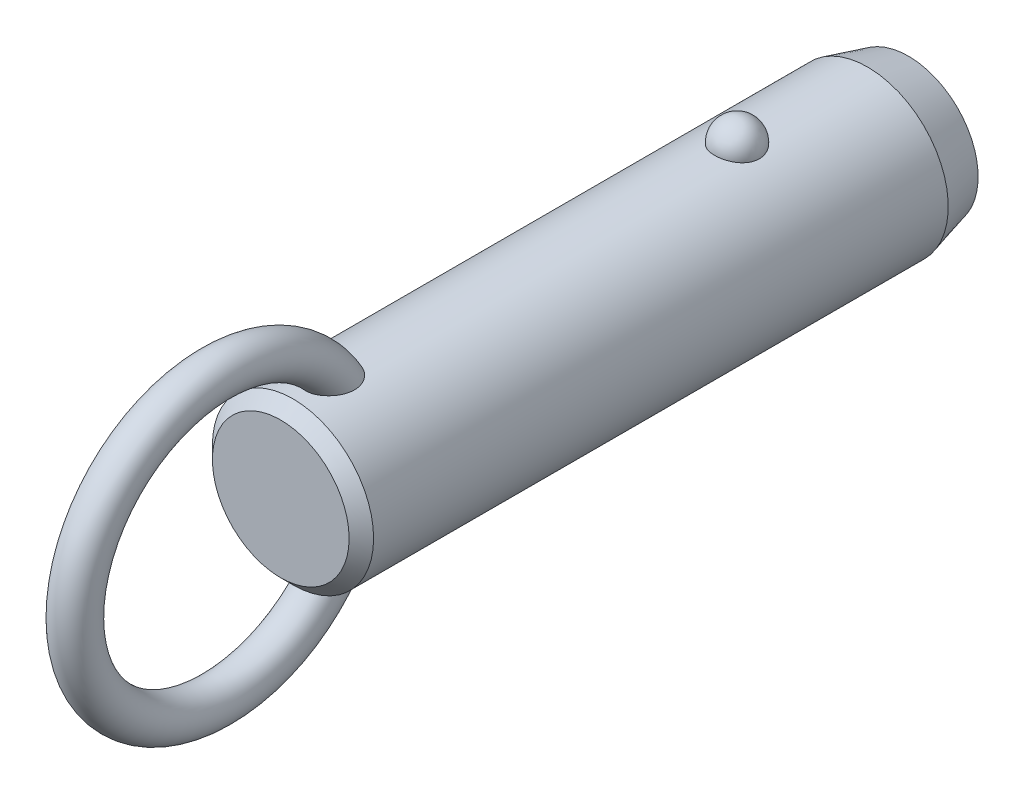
SolidWorks part; units mm, degrees
ref_plane "Front Plane" through (0, 0, 0) normal (0, 0, 1) x (1, 0, 0)
ref_plane "Top Plane" through (0, 0, 0) normal (0, 1, 0) x (1, 0, 0)
ref_plane "Right Plane" through (0, 0, 0) normal (1, 0, 0) x (0, 0, -1)
sketch "Sketch2" plane through (0, 0, 0) normal (0, 0, 1) x (1, 0, 0)
  circle A0 centre (0, 0) radius 7.9
  point P3 (0, 7.9)
  dimension "D1" = 15.8
extrude "Boss-Extrude1" add sketch "Sketch2" along normal blind 33
sketch "Sketch3" plane through (0, 0, 0) normal (0, 0, -1) x (-1, 0, 0)
  circle A0 centre (0, 0) radius 7.9
  dimension "D1" = 15.8
extrude "Boss-Extrude2" add sketch "Sketch3" along normal blind 19
chamfer "Chamfer1" distance 4 angle 15 1 edges at (-7.9, 0, -19)
sketch "Sketch12" plane through (0, 0, 0) normal (1, 0, 0) x (0, 0, -1)
  line L0 (-33, 7.9) -> (-33, -7.9) construction
  point P0 (-33, 0)
sketch "Sketch13" plane through (0, 0, 0) normal (1, 0, 0) x (0, 0, -1)
  circle A0 centre (-48.85, 0) radius 15.85
  point P2 (-33, 0)
  dimension "D1" = 31.7
sketch "Sketch14" plane through (0, 0, 0) normal (0, 1, 0) x (1, 0, 0)
  circle A0 centre (0, -35) radius 2
  point P2 (0, -33)
  dimension "D1" = 4
sweep "Sweep1" add profiles "Sketch14" path "Sketch13"
sketch "Sketch15" plane through (0, 0, 33) normal (0, 0, 1) x (1, 0, 0)
  circle A0 centre (0, 0) radius 7.9
  dimension "D1" = 15.8
extrude "Boss-Extrude3" add sketch "Sketch15" along normal blind 9.52
chamfer "Chamfer2" distance 1.2 angle 45 1 edges at (7.9, 0, 42.52)
sketch "Sketch18" plane through (0, 0, 0) normal (1, 0, 0) x (0, 0, -1)
  line L0 (15, 7.9) -> (-35.1091, 7.9) construction
  line L1 (2.2, 10.1) -> (2.2, 5.7)
  line L2 (-35.1091, -7.9) -> (15, -7.9) construction
  arc A0 (2.2, 10.1) -> (2.2, 5.7) centre (2.2, 7.9) ccw
  point P4 (0, 7.9)
  dimension "D1" = 18
revolve "Revolve1" add sketch "Sketch18" angle 360 about L1
